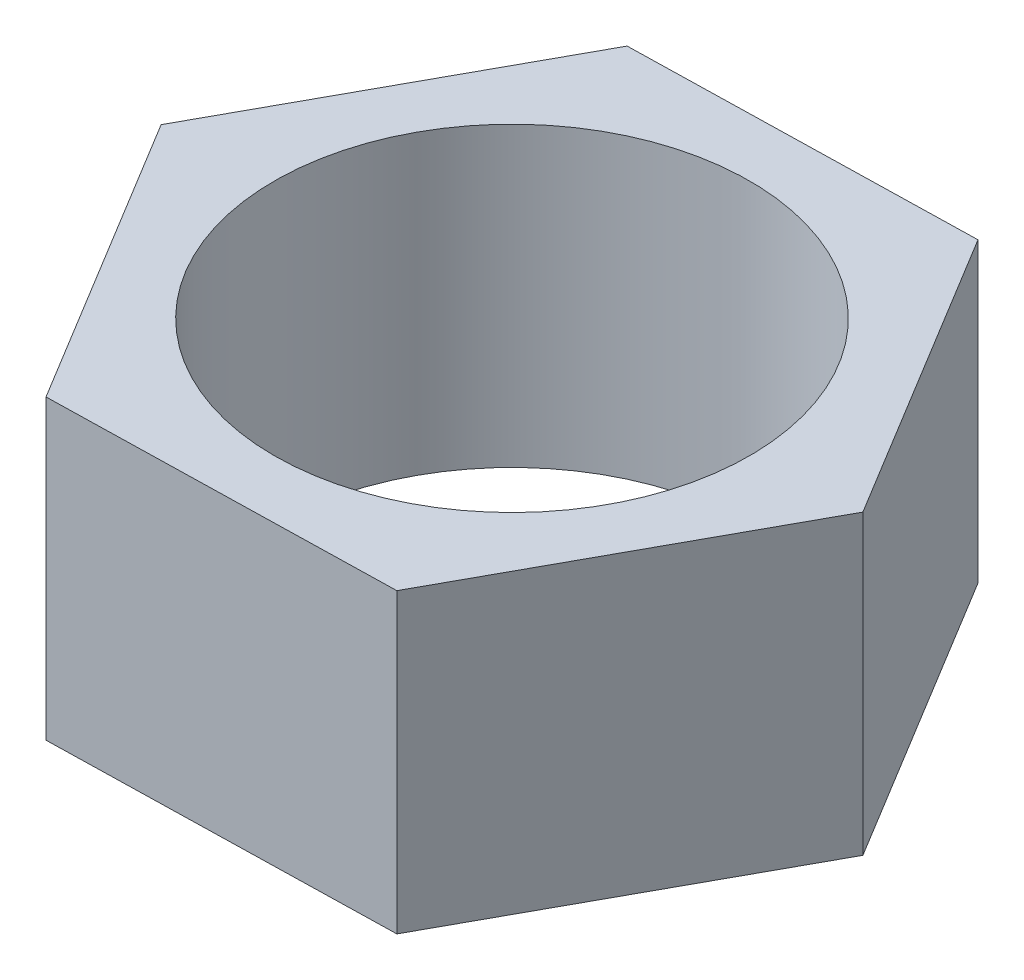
SolidWorks part; units mm, degrees
ref_plane "Front Plane" through (0, 0, 0) normal (0, 0, 1) x (1, 0, 0)
ref_plane "Top Plane" through (0, 0, 0) normal (0, 1, 0) x (1, 0, 0)
ref_plane "Right Plane" through (0, 0, 0) normal (1, 0, 0) x (0, 0, -1)
sketch "Sketch1" plane through (0, 0, 0) normal (0, 1, 0) x (1, 0, 0)
  line L1 (2.998, -4.9341) -> (5.7721, 0.1292)
  line L2 (5.7721, 0.1292) -> (2.7741, 5.0634)
  line L3 (2.7741, 5.0634) -> (-2.998, 4.9341)
  line L4 (-2.998, 4.9341) -> (-5.7721, -0.1292)
  line L5 (-5.7721, -0.1292) -> (-2.7741, -5.0634)
  line L6 (-2.7741, -5.0634) -> (2.998, -4.9341)
  circle A0 centre (0, 0) radius 5 construction
extrude "Boss-Extrude1" add sketch "Sketch1" along normal blind 5
sketch "Sketch2" plane through (0, 5, 0) normal (0, 1, 0) x (1, 0, 0)
  circle A0 centre (0, 0) radius 4
extrude "Cut-Extrude1" cut sketch "Sketch2" against normal blind 14
